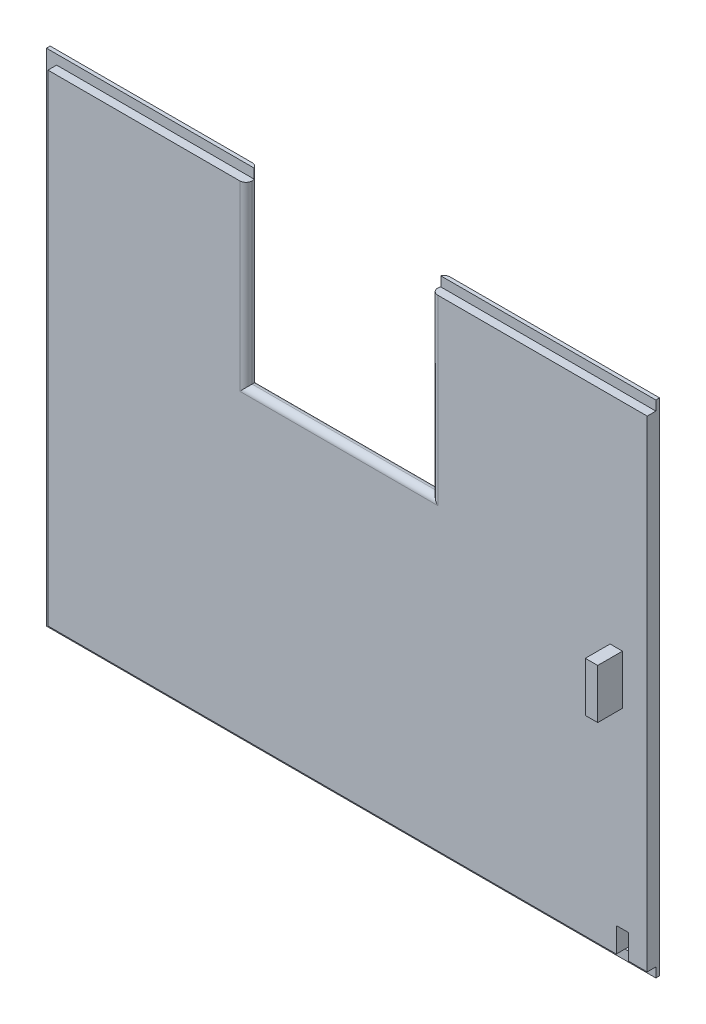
SolidWorks part; units mm, degrees
ref_plane "Front Plane" through (0, 0, 0) normal (0, 0, 1) x (1, 0, 0)
ref_plane "Top Plane" through (0, 0, 0) normal (0, 1, 0) x (1, 0, 0)
ref_plane "Right Plane" through (0, 0, 0) normal (1, 0, 0) x (0, 0, -1)
sketch "Sketch1" plane through (0, 0, 0) normal (0, 0, 1) x (1, 0, 0)
  line L1 (0, 0) -> (98.5, 0)
  line L2 (0, 0) -> (0, 80.9)
  line L3 (0, 80.9) -> (98.5, 80.9)
  line L4 (98.5, 0) -> (98.5, 80.9)
  dimension "D1" = 98.5
  dimension "D2" = 80.9
extrude "Boss-Extrude1" add sketch "Sketch1" along normal blind 2
sketch "Sketch3" plane through (98.5, 0, 0) normal (1, 0, 0) x (0, 0, -1)
  line L1 (-2, 80.9) -> (-0.6, 80.9)
  line L2 (-2, 80.9) -> (-2, 79.35)
  line L3 (-2, 79.35) -> (-0.6, 79.35)
  line L4 (-0.6, 80.9) -> (-0.6, 79.35)
  line L5 (-2, 0) -> (-0.6, 0)
  line L6 (-2, 0) -> (-2, 1.55)
  line L7 (-2, 1.55) -> (-0.6, 1.55)
  line L8 (-0.6, 0) -> (-0.6, 1.55)
  dimension "D1" = 1.4
  dimension "D2" = 1.4
  dimension "D3" = 1.55
  dimension "D4" = 1.55
extrude "Cut-Extrude1" cut sketch "Sketch3" against normal up to next
sketch "Sketch4" plane through (0, 79.35, 0) normal (0, 1, 0) x (1, 0, 0)
  line L0 (0, -0.6) -> (98.5, -0.6) construction
  line L1 (0, -2) -> (1.65, -2)
  line L2 (0, -2) -> (0, -0.6)
  line L3 (0, -0.6) -> (1.65, -0.6)
  line L4 (1.65, -2) -> (1.65, -0.6)
  dimension "D1" = 1.65
extrude "Cut-Extrude2" cut sketch "Sketch4" against normal up to next
sketch "Sketch5" plane through (0, 0, 0) normal (0, 0, -1) x (-1, 0, 0)
  line L0 (-98.5, 80.9) -> (-98.5, 0) construction
  line L1 (-94.5, 44.45) -> (-92.5, 44.45)
  line L2 (-94.5, 44.45) -> (-94.5, 36.45)
  line L3 (-94.5, 36.45) -> (-92.5, 36.45)
  line L4 (-92.5, 44.45) -> (-92.5, 36.45)
  point P8 (-94.5, 40.45)
  point P9 (-98.5, 40.45)
  dimension "D1" = 8
  dimension "D2" = 2
  dimension "D3" = 4
extrude "Boss-Extrude2" add sketch "Sketch5" against normal blind 6
sketch "Sketch6" plane through (0, 80.9, 0) normal (0, 1, 0) x (1, 0, 0)
  line L0 (98.5, 0) -> (0, 0) construction
  line L1 (33.65, 0) -> (63.65, 0)
  line L2 (33.65, 0) -> (33.65, -2)
  line L3 (33.65, -2) -> (63.65, -2)
  line L4 (63.65, 0) -> (63.65, -2)
  line L5 (1.65, -2) -> (98.5, -2) construction
  line L6 (1.65, -2) -> (1.65, -0.6) construction
  dimension "D1" = 32
  dimension "D2" = 30
extrude "Cut-Extrude3" cut sketch "Sketch6" against normal blind 30
sketch "Sketch7" plane through (0, 0, 2) normal (0, 0, 1) x (1, 0, 0)
  line L0 (1.65, 1.55) -> (98.5, 1.55) construction
  line L1 (93.5, 1.55) -> (95.5, 1.55)
  line L2 (93.5, 1.55) -> (93.5, 5.55)
  line L3 (93.5, 5.55) -> (95.5, 5.55)
  line L4 (95.5, 1.55) -> (95.5, 5.55)
  line L5 (98.5, 1.55) -> (98.5, 79.35) construction
  dimension "D1" = 3
  dimension "D2" = 2
  dimension "D3" = 4
extrude "Cut-Extrude4" cut sketch "Sketch7" against normal through all
fillet "Fillet1" radius 1 6 edges at (33.65, 65.9, 0) (33.65, 65.125, 2) (63.65, 65.125, 2) (48.65, 50.9, 2) (63.65, 65.9, 0) (48.65, 50.9, 0)
